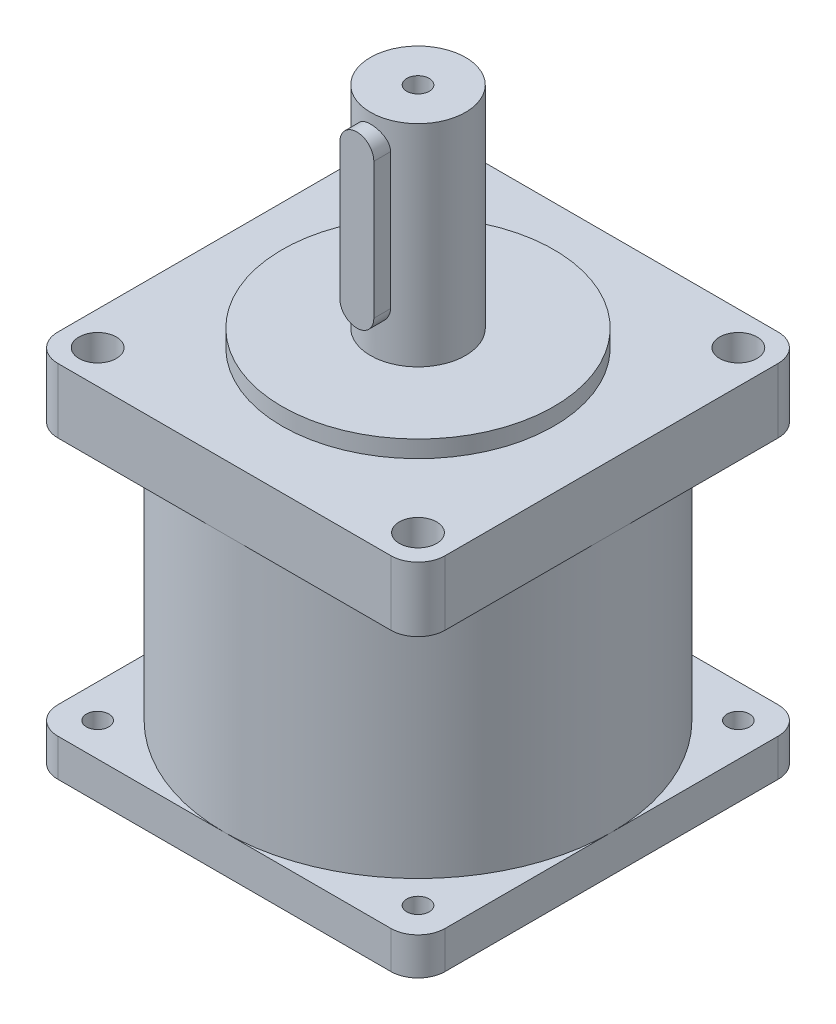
SolidWorks part; units mm, degrees
ref_plane "前视" through (0, 0, 0) normal (0, 0, 1) x (1, 0, 0)
ref_plane "上视" through (0, 0, 0) normal (0, 1, 0) x (1, 0, 0)
ref_plane "右视" through (0, 0, 0) normal (1, 0, 0) x (0, 0, -1)
sketch "草图1" plane through (0, 0, 0) normal (0, 1, 0) x (1, 0, 0)
  line L1 (-28.5, 28.5) -> (28.5, 28.5)
  line L2 (-28.5, 28.5) -> (-28.5, -28.5)
  line L3 (-28.5, -28.5) -> (28.5, -28.5)
  line L4 (28.5, 28.5) -> (28.5, -28.5)
  line L5 (-28.5, 28.5) -> (28.5, -28.5) construction
  line L6 (-28.5, -28.5) -> (28.5, 28.5) construction
  point P0 (0, 0)
extrude "凸台-拉伸1" add sketch "草图1" along normal blind 9.5
ref_plane "基准面1" through (0, 9.5, 0) normal (0, 1, 0) x (1, 0, 0)
sketch "草图2" plane through (0, 9.5, 0) normal (0, 1, 0) x (1, 0, 0)
  circle A0 centre (0, 0) radius 20
  dimension "D1" = 40
extrude "凸台-拉伸2" add sketch "草图2" along normal blind 2.5
sketch "草图3" plane through (0, 9.5, 0) normal (0, 1, 0) x (1, 0, 0)
  circle A0 centre (0, 0) radius 7
  dimension "D1" = 14
extrude "凸台-拉伸3" add sketch "草图3" along normal blind 33.5
sketch "草图4" plane through (0, 9.5, 0) normal (0, 1, 0) x (1, 0, 0)
  line L1 (-23.57, 23.57) -> (23.57, 23.57)
  line L2 (-23.57, 23.57) -> (-23.57, -23.57)
  line L3 (-23.57, -23.57) -> (23.57, -23.57)
  line L4 (23.57, 23.57) -> (23.57, -23.57)
  line L5 (-23.57, 23.57) -> (23.57, -23.57) construction
  line L6 (-23.57, -23.57) -> (23.57, 23.57) construction
  point P0 (0, 0)
sketch "草图5" plane through (0, 9.5, 0) normal (0, 1, 0) x (1, 0, 0)
  circle A0 centre (-23.57, 23.57) radius 2.75
  circle A1 centre (-23.57, -23.57) radius 2.75
  circle A2 centre (23.57, -23.57) radius 2.75
  circle A3 centre (23.57, 23.57) radius 2.75
  dimension "D1" = 5.5
  dimension "D2" = 5.5
  dimension "D3" = 5.5
  dimension "D4" = 5.5
extrude "切除-拉伸1" cut sketch "草图5" against normal blind 9.5
ref_plane "基准面2" through (0, 43, 0) normal (0, 1, 0) x (1, 0, 0)
hole_wizard "M4 螺纹孔1" positions "草图7" profile "草图6" tap size "M4" standard "ISO"
sketch "草图7" plane through (0, 43, 0) normal (0, 1, 0) x (1, 0, 0)
  point P0 (0, 0)
sketch "草图6" plane through (0, 43, 0) normal (1, 0, 0) x (0, 0, 1)
  line L0 (0, 0) -> (0, 12.4914)
  line L1 (0, 12.4914) -> (1.65, 11.5)
  line L2 (1.65, 11.5) -> (1.65, 0)
  line L5 (1.65, 0) -> (0, 0)
  line L10 (0, 12.4914) -> (-1.65, 11.5) construction
  line L11 (0, -6.35) -> (0, 107.95) construction
  dimension "螺纹孔钻头直径" = 3.3
  dimension "螺纹孔钻头深度" = 11.5
  dimension "导头角度" = 118
ref_plane "基准面3" through (0, 0, 4) normal (0, 0, 1) x (1, 0, 0)
sketch "草图8" plane through (0, 0, 4) normal (0, 0, 1) x (1, 0, 0)
  line L4 (-2.5, 39) -> (-2.5, 19)
  line L6 (2.5, 39) -> (2.5, 19)
  line L7 (-2.5, 39) -> (2.5, 19) construction
  line L8 (-2.5, 19) -> (2.5, 39) construction
  arc A0 (-2.5, 39) -> (2.5, 39) centre (0, 39) cw
  arc A1 (-2.5, 19) -> (2.5, 19) centre (0, 19) ccw
  point P5 (0, 29)
  dimension "D1" = 2.5
  dimension "D2" = 2.5
extrude "凸台-拉伸4" add sketch "草图8" along normal blind 5
sketch "草图9" plane through (0, 0, 0) normal (0, 1, 0) x (1, 0, 0)
  circle A0 centre (0, 0) radius 28.5
  dimension "D1" = 57
extrude "凸台-拉伸5" add sketch "草图9" against normal blind 38
ref_plane "基准面4" through (0, -38, 0) normal (0, -1, 0) x (-1, 0, 0)
sketch "草图10" plane through (0, -38, 0) normal (0, -1, 0) x (-1, 0, 0)
  line L1 (28.5, -28.5) -> (-28.5, -28.5)
  line L2 (28.5, -28.5) -> (28.5, 28.5)
  line L3 (28.5, 28.5) -> (-28.5, 28.5)
  line L4 (-28.5, -28.5) -> (-28.5, 28.5)
  line L5 (28.5, -28.5) -> (-28.5, 28.5) construction
  line L6 (28.5, 28.5) -> (-28.5, -28.5) construction
  point P0 (0, 0)
extrude "凸台-拉伸6" add sketch "草图10" along normal blind 5.5
hole_wizard "M4 螺纹孔2" positions "草图12" profile "草图11" tap size "M4" standard "ISO"
sketch "草图12" plane through (0, -38, 0) normal (0, -1, 0) x (-1, 0, 0)
  point P0 (23.57, -23.57)
  point P3 (23.57, 23.57)
  point P6 (-23.57, 23.57)
  point P9 (-23.57, -23.57)
sketch "草图11" plane through (-23.57, -38, 23.57) normal (1, 0, 0) x (0, 0, 1)
  line L0 (0, 0) -> (0, 9.9914)
  line L1 (0, 9.9914) -> (1.65, 9)
  line L2 (1.65, 9) -> (1.65, 0)
  line L5 (1.65, 0) -> (0, 0)
  line L10 (0, 9.9914) -> (-1.65, 9) construction
  line L11 (0, -6.35) -> (0, 107.95) construction
  dimension "螺纹孔钻头直径" = 3.3
  dimension "螺纹孔钻头深度" = 9
  dimension "导头角度" = 118
fillet "圆角1" radius 4 8 edges at (-28.5, -40.75, 28.5) (28.5, -40.75, 28.5) (28.5, -40.75, -28.5) (-28.5, -40.75, -28.5) (-28.5, 4.75, -28.5) (28.5, 4.75, -28.5) (28.5, 4.75, 28.5) (-28.5, 4.75, 28.5)
ref_plane "基准面5" through (0, -43.5, 0) normal (0, -1, 0) x (-1, 0, 0)
sketch "草图13" plane through (0, -43.5, 0) normal (0, -1, 0) x (-1, 0, 0)
  circle A0 centre (0, 0) radius 19.05
  dimension "D1" = 38.1
extrude "切除-拉伸2" cut sketch "草图13" against normal blind 2.5
sketch "草图14" plane through (0, -43.5, 0) normal (0, -1, 0) x (-1, 0, 0)
  circle A0 centre (0, 0) radius 4
  dimension "D1" = 8
extrude "切除-拉伸3" cut sketch "草图14" against normal blind 7
